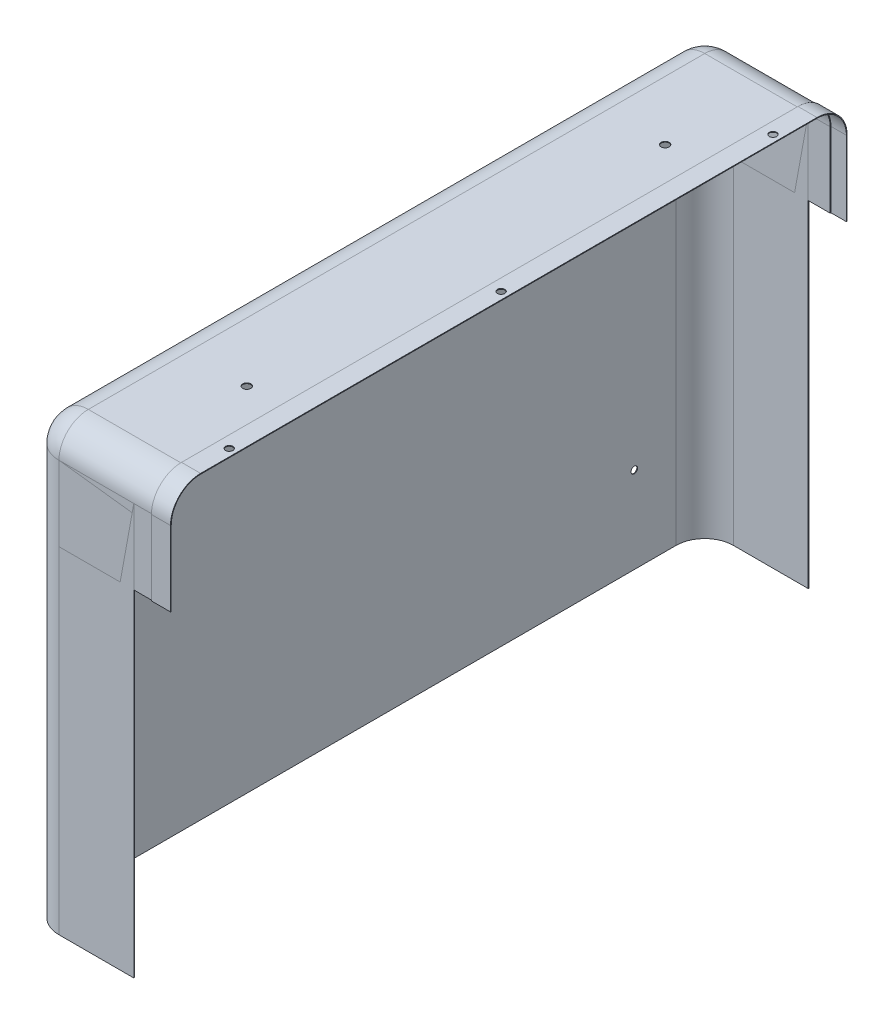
SolidWorks part; units mm, degrees
ref_plane "Plan de face" through (0, 0, 0) normal (0, 0, 1) x (1, 0, 0)
ref_plane "Plan de dessus" through (0, 0, 0) normal (0, 1, 0) x (1, 0, 0)
ref_plane "Plan de droite" through (0, 0, 0) normal (1, 0, 0) x (0, 0, -1)
sketch "Esquisse1" plane through (0, 0, 0) normal (0, 0, 1) x (1, 0, 0)
  line L0 (-172, -600) -> (-172, -40)
  line L1 (-132, 0) -> (0, 0)
  arc A0 (-172, -40) -> (-132, 0) centre (-132, -40) cw
  point P9 (-172, 0)
  dimension "D5" = 40
  dimension "D1" = 600
  dimension "D2" = 172
sketch "Esquisse3" plane through (0, 0, 0) normal (1, 0, 0) x (0, 0, -1)
  line L0 (0, 0) -> (-529, 0)
  line L1 (0, 0) -> (311, 0)
  line L2 (351, -40) -> (351, -142)
  line L3 (-569, -40) -> (-569, -142)
  line L4 (-568, -40) -> (-568, -142)
  line L5 (0, -1) -> (-529, -1)
  line L6 (0, -1) -> (311, -1)
  line L7 (350, -40) -> (350, -142)
  line L8 (-569, -142) -> (-568, -142)
  line L9 (351, -142) -> (350, -142)
  arc A0 (311, 0) -> (351, -40) centre (311, -40) cw
  arc A1 (-569, -40) -> (-529, 0) centre (-529, -40) cw
  arc A2 (-568, -40) -> (-529, -1) centre (-529, -40) cw
  arc A3 (311, -1) -> (350, -40) centre (311, -40) cw
  point P8 (351, 0)
  point P11 (-569, 0)
  dimension "D4" = 40
  dimension "D1" = 920
  dimension "D2" = 142
  dimension "D3" = 351
  dimension "D5" = 142
sweep "Balayage1" add profiles "Esquisse3" path "Esquisse1"
sketch "Esquisse7" plane through (0, 0, 0) normal (1, 0, 0) x (0, 0, -1)
  line L0 (-569, -40) -> (-569, -142) construction
  line L1 (311, 0) -> (-529, 0) construction
  line L2 (351, -142) -> (351, -40) construction
  line L3 (-569, -40) -> (-569, -142)
  line L4 (311, 0) -> (-529, 0)
  line L5 (351, -142) -> (351, -40)
  arc A0 (-529, 0) -> (-569, -40) centre (-529, -40) ccw construction
  arc A1 (351, -40) -> (311, 0) centre (311, -40) ccw construction
  arc A2 (-529, 0) -> (-569, -40) centre (-529, -40) ccw
  arc A3 (351, -40) -> (311, 0) centre (311, -40) ccw
extrude "Extru.-Mince9" add sketch "Esquisse7" along normal blind 21 and the other way blind 5 thin
sketch "Esquisse11" plane through (-172, 0, 0) normal (-1, 0, 0) x (0, 0, 1)
  line L0 (-240.174, -434.905) -> (294.2972, -434.905)
sketch "Esquisse12" plane through (-172, 0, 0) normal (-1, 0, 0) x (0, 0, 1)
  text T0 "ISEKI" font "Century Gothic" height in points 500
extrude "Extrusion6" add sketch "Esquisse12" along normal blind 1
sketch "Esquisse14" plane through (-172, 0, 0) normal (-1, 0, 0) x (0, 0, 1)
  circle A0 centre (-253.9758, -482.5) radius 4.5
  circle A1 centre (470.0242, -482.5) radius 4.8996
  dimension "D3" = 9
  dimension "D4" = 9.7992
extrude "Enlèv. mat.-Extru.3" cut sketch "Esquisse14" against normal blind 10
sketch "Esquisse15" plane through (0, 0, 0) normal (0, 1, 0) x (-1, 0, 0)
  line L0 (-21, -311) -> (-21, 529) construction
  line L2 (-21, 570) -> (5, 570) construction
  line L3 (132, -351) -> (5, -351) construction
  circle A0 centre (-11, -261) radius 5
  circle A1 centre (-11, 109.5) radius 5
  circle A2 centre (-11, 480) radius 5
  point P6 (-8, 570)
  dimension "D1" = 10
  dimension "D2" = 10
  dimension "D3" = 10
  dimension "D4" = 90
  dimension "D5" = 90
  dimension "D6" = 370.5
  dimension "D7" = 10
  dimension "D8" = 10
  dimension "D9" = 10
extrude "Enlèv. mat.-Extru.5" cut sketch "Esquisse15" along normal blind 10
sketch "Esquisse17" plane through (0, 0, 0) normal (0, 1, 0) x (-1, 0, 0)
  line L0 (-21, -311) -> (-21, 529) construction
  circle A0 centre (51.5, 393.5242) radius 5.5
  circle A1 centre (51.5, -176.4758) radius 5.5
  dimension "D1" = 11
  dimension "D2" = 11
  dimension "D5" = 72.5
extrude "Enlèv. mat.-Extru.6" cut sketch "Esquisse17" against normal blind 10
